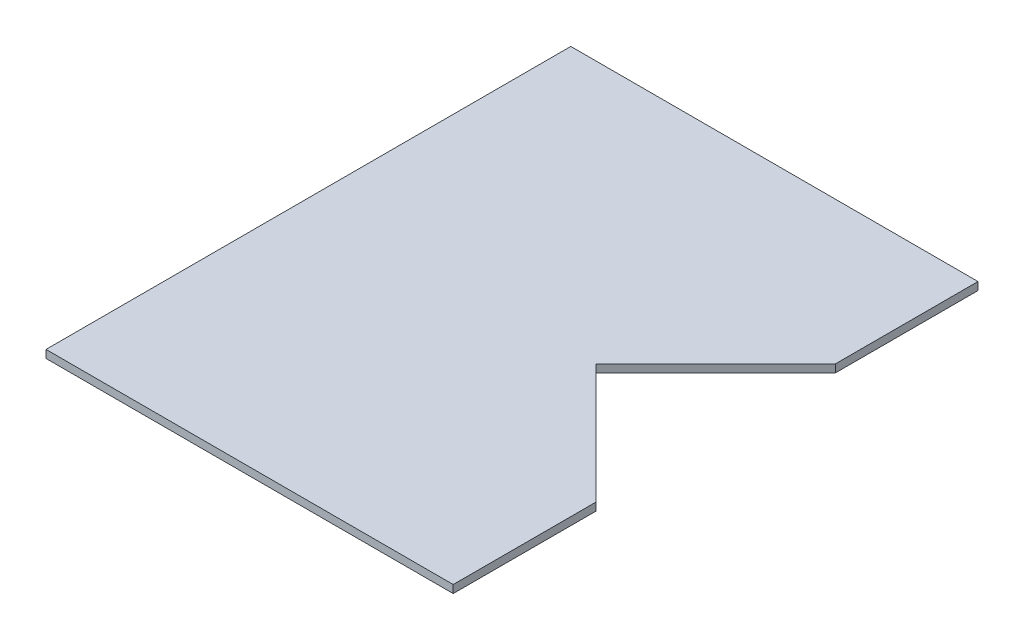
SolidWorks part; units mm, degrees
ref_plane "Front Plane" through (0, 0, 0) normal (0, 0, 1) x (1, 0, 0)
ref_plane "Top Plane" through (0, 0, 0) normal (0, 1, 0) x (1, 0, 0)
ref_plane "Right Plane" through (0, 0, 0) normal (1, 0, 0) x (0, 0, -1)
body saved out of another part "Stock-example-1"
